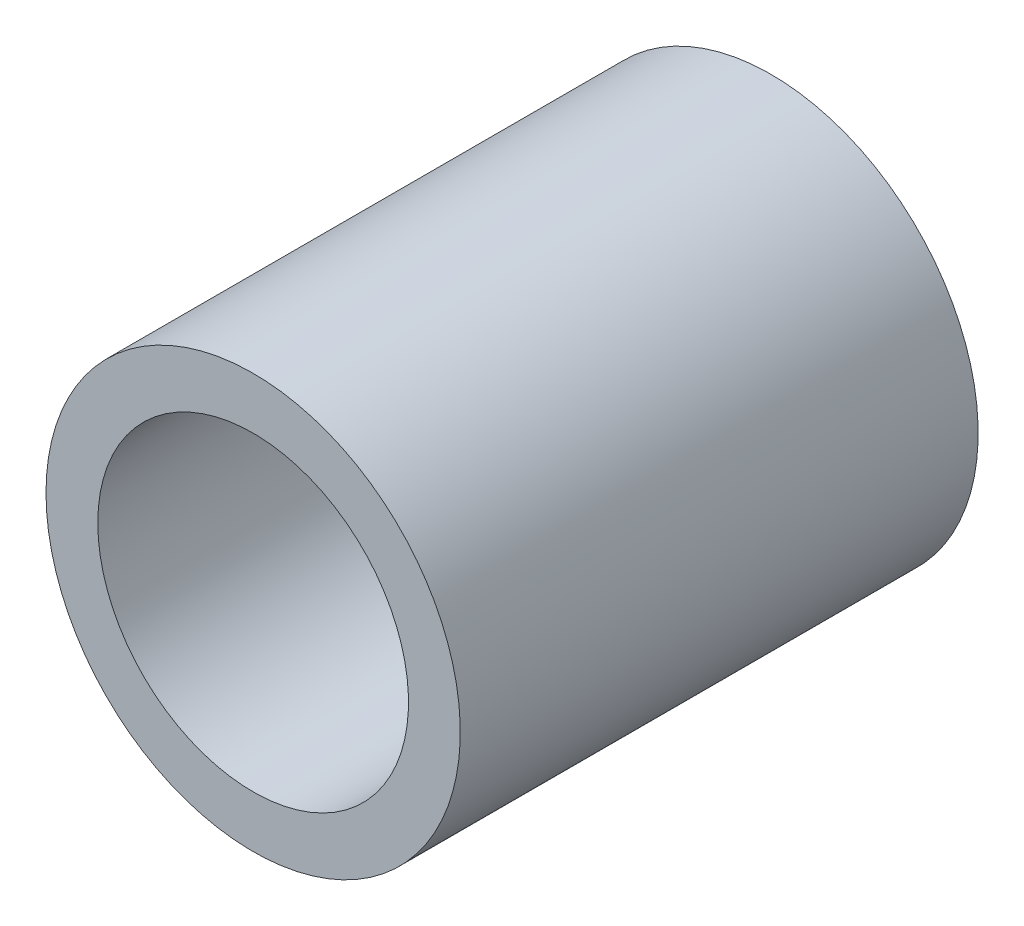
SolidWorks part; units mm, degrees
ref_plane "Plan de face" through (0, 0, 0) normal (0, 0, 1) x (1, 0, 0)
ref_plane "Plan de dessus" through (0, 0, 0) normal (0, 1, 0) x (1, 0, 0)
ref_plane "Plan de droite" through (0, 0, 0) normal (1, 0, 0) x (0, 0, -1)
sketch "Esquisse1" plane through (0, 0, 0) normal (0, 0, 1) x (1, 0, 0)
  circle A0 centre (0, 0) radius 4
  circle A1 centre (0, 0) radius 3
extrude "Extrusion1" add sketch "Esquisse1" along normal blind 10
